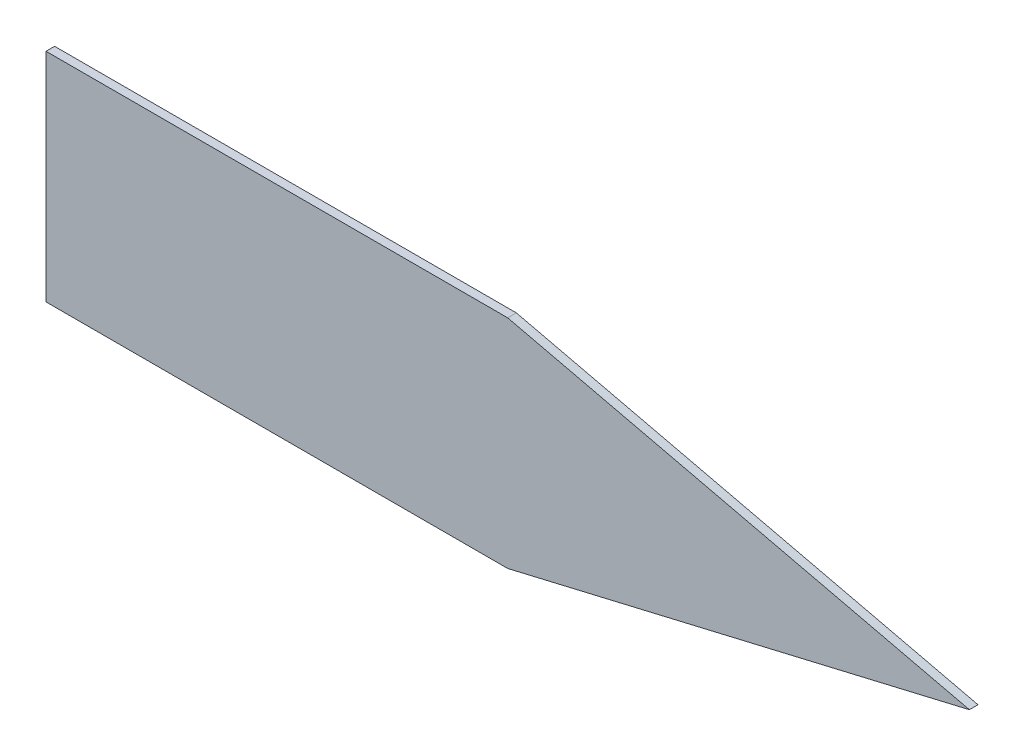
SolidWorks part; units mm, degrees
ref_plane "Vorderansicht" through (0, 0, 0) normal (0, 0, 1) x (1, 0, 0)
ref_plane "Oben" through (0, 0, 0) normal (0, 1, 0) x (1, 0, 0)
ref_plane "Rechts" through (0, 0, 0) normal (1, 0, 0) x (0, 0, -1)
sketch "Skizze1" plane through (0, 0, 0) normal (0, 0, 1) x (1, 0, 0)
  line L0 (53.5985, 0) -> (0, 12.6006)
  line L1 (0, -12.6006) -> (-53.5985, -12.6006)
  line L3 (0, 12.6006) -> (-53.5985, 12.6006)
  line L4 (-53.5985, -12.6006) -> (-53.5985, 12.6006)
  line L5 (26.7993, -6.3003) -> (-53.5985, 12.6006) construction
  line L6 (26.7993, 6.3003) -> (-53.5985, -12.6006) construction
  line L8 (0, -12.6006) -> (53.5985, 0)
  point P0 (0, 0)
extrude "Aufsatz-Linear austragen1" add sketch "Skizze1" along normal mid plane 1
